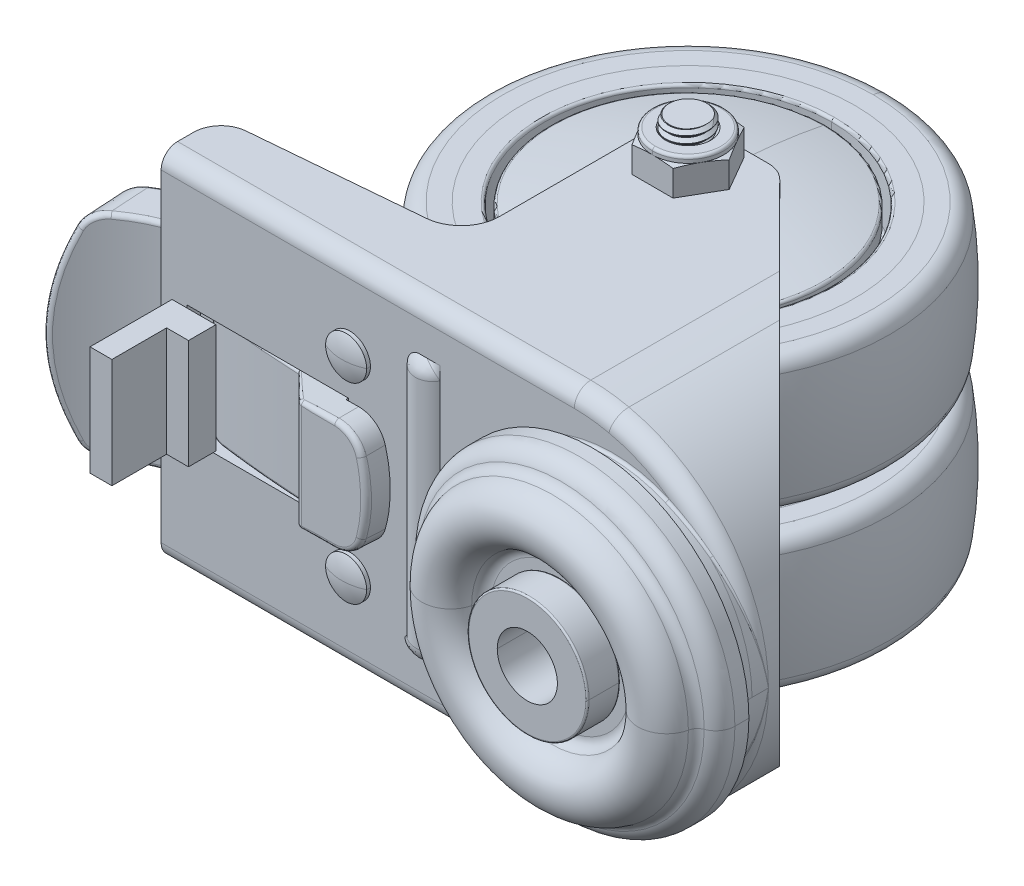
SolidWorks part; units mm, degrees
ref_plane "Front" through (0, 0, 0) normal (0, 0, 1) x (1, 0, 0)
ref_plane "Top" through (0, 0, 0) normal (0, 1, 0) x (1, 0, 0)
ref_plane "Right" through (0, 0, 0) normal (1, 0, 0) x (0, 0, -1)
imported_body "Defeature ausgeführt1"
imported_body "Defeature ausgeführt2"
imported_body "Defeature ausgeführt3"
imported_body "Defeature ausgeführt4"
imported_body "Defeature ausgeführt5"
imported_body "Defeature ausgeführt6"
imported_body "Defeature ausgeführt7"
imported_body "Defeature ausgeführt8"
imported_body "Defeature ausgeführt9"
imported_body "Defeature ausgeführt10"
imported_body "Defeature ausgeführt11"
sketch "Skizze2" plane through (0, 0, 0) normal (0, 1, 0) x (1, 0, 0)
  line L0 (-72.5, 3.5728) -> (-80.5, 3.5728)
  line L1 (-48.3, 3.5728) -> (-77.8, 3.5728) construction
  line L2 (-72.5, 3.5728) -> (-72.5, -1.4272)
  line L3 (-72.5, -1.4272) -> (-76.5, -1.4272)
  line L4 (-76.5, -1.4272) -> (-76.5, -11.4272)
  line L5 (-76.5, -11.4272) -> (-80.5, -11.4272)
  line L6 (-80.5, -11.4272) -> (-80.5, 3.5728)
  line L8 (-82.5, 3.5728) -> (-6.9763, 3.5728) construction
  line L9 (-80.5, 3.5728) -> (-82.5, 3.5728) construction
  point P10 (0, 0)
  point P14 (0, 0)
  dimension "D1" = 8
  dimension "D2" = 5
  dimension "D3" = 15
  dimension "D4" = 4
  dimension "D5" = 2
extrude "Aufsatz-Linear austragen2" add sketch "Skizze2" along normal mid plane 20
